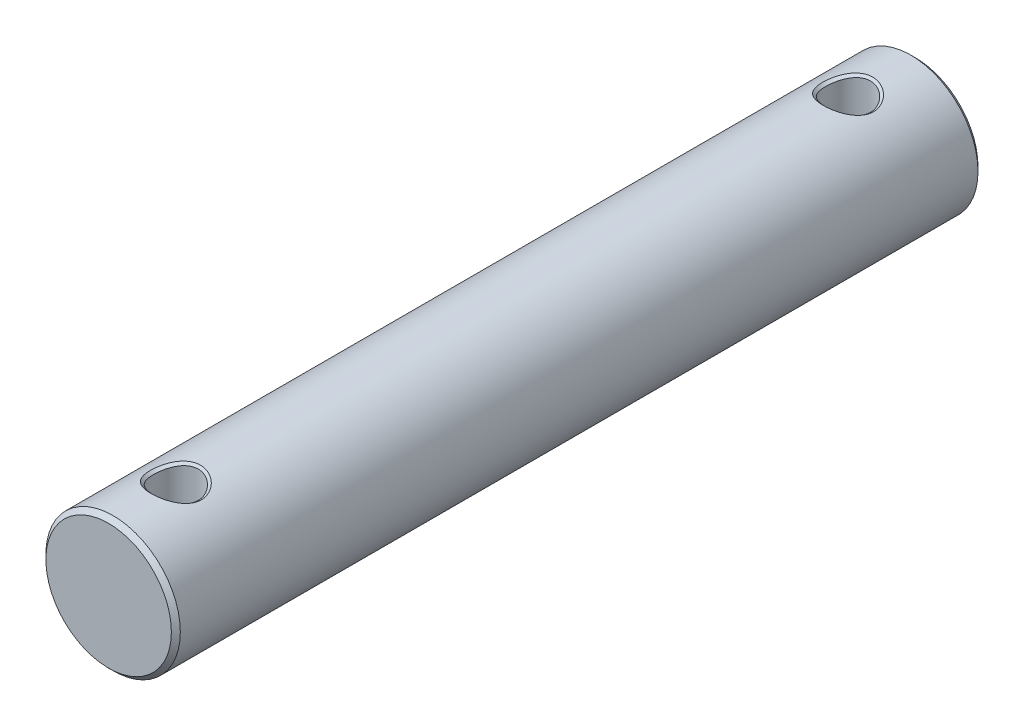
SolidWorks part; units mm, degrees
ref_plane "Plan de face" through (0, 0, 0) normal (0, 0, 1) x (1, 0, 0)
ref_plane "Plan de dessus" through (0, 0, 0) normal (0, 1, 0) x (1, 0, 0)
ref_plane "Plan de droite" through (0, 0, 0) normal (1, 0, 0) x (0, 0, -1)
sketch "Esquisse1" plane through (0, 0, 0) normal (0, 0, 1) x (1, 0, 0)
  circle A0 centre (0, 0) radius 15
  dimension "D1" = 30
extrude "Extrusion1" add sketch "Esquisse1" along normal blind 180
sketch "Esquisse2" plane through (0, 0, 0) normal (0, 1, 0) x (1, 0, 0)
  line L0 (15, 0) -> (-15, 0) construction
  line L1 (-15, -180) -> (15, -180) construction
  circle A0 centre (0, -15) radius 5
  circle A1 centre (0, -165) radius 5
  dimension "D1" = 10
  dimension "D2" = 10
  dimension "D3" = 15
  dimension "D4" = 15
extrude "Enlèv. mat.-Extru.1" cut sketch "Esquisse2" against normal mid plane 30
chamfer "Chanfrein1" distance 1 angle 45 2 edges at (15, 0, 0) (15, 0, 180)
chamfer "Chanfrein2" distance 0.5 angle 45 4 edges at (-0.8497, -14.9759, 160.0727) (0.8497, 14.9759, 160.0727) (-0.8497, -14.9759, 10.0727) (0.8497, 14.9759, 10.0727)
